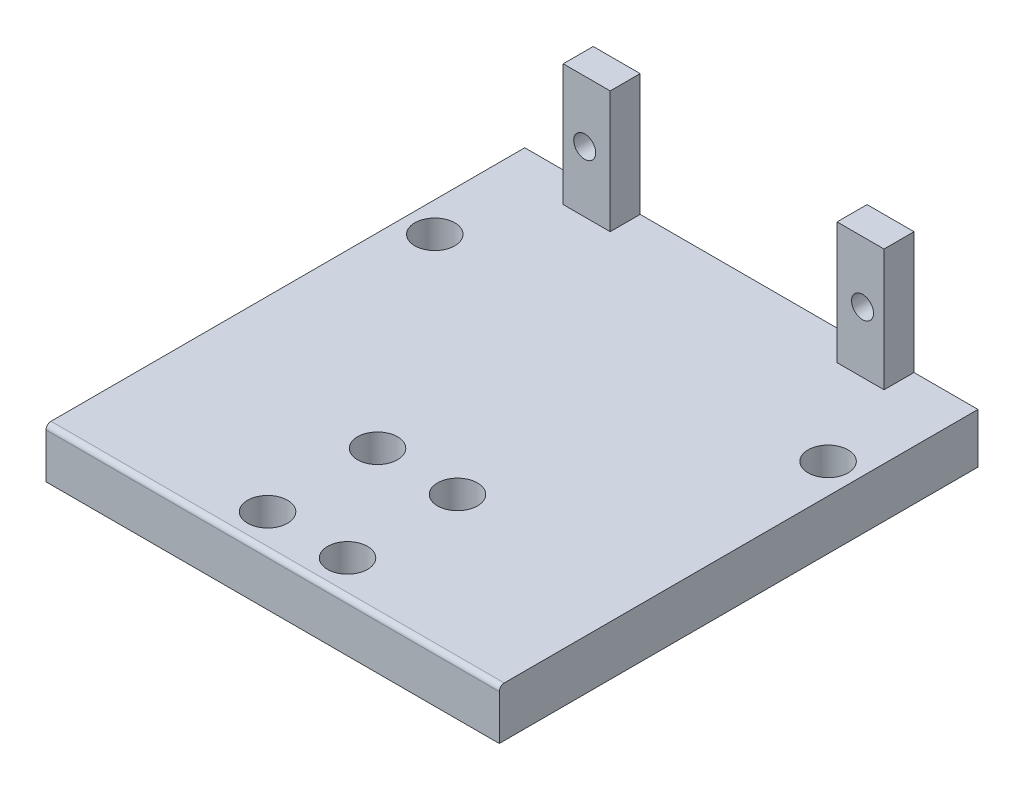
SolidWorks part; units mm, degrees
ref_plane "Front Plane" through (0, 0, 0) normal (0, 0, 1) x (1, 0, 0)
ref_plane "Top Plane" through (0, 0, 0) normal (0, 1, 0) x (1, 0, 0)
ref_plane "Right Plane" through (0, 0, 0) normal (1, 0, 0) x (0, 0, -1)
sketch "Sketch1" plane through (0, 0, 0) normal (0, 0, 1) x (1, 0, 0)
  line L0 (0, 0) -> (0, 56)
  line L1 (0, 56) -> (75.6, 56)
  line L2 (75.6, 56) -> (75.6, 0)
  line L3 (75.6, 0) -> (70.6, 0)
  line L4 (70.6, 0) -> (70.6, 51)
  line L5 (70.6, 51) -> (5, 51)
  line L6 (5, 51) -> (5, 0)
  line L7 (5, 0) -> (0, 0)
  dimension "D1" = 5
  dimension "D2" = 75.6
  dimension "D3" = 5
  dimension "D4" = 5
  dimension "D5" = 56
extrude "Boss-Extrude1" add sketch "Sketch1" along normal blind 47.9
sketch "Sketch4" plane through (0, 0, 0) normal (0, -1, 0) x (1, 0, 0)
  line L1 (-6.946, 52.7093) -> (84.5495, 52.7093)
  line L2 (-6.946, 52.7093) -> (-6.946, -4.3084)
  line L3 (-6.946, -4.3084) -> (84.5495, -4.3084)
  line L4 (84.5495, 52.7093) -> (84.5495, -4.3084)
extrude "Cut-Extrude3" cut sketch "Sketch4" against normal blind 20
sketch "Sketch6" plane through (0, 56, 0) normal (0, 1, 0) x (1, 0, 0)
  line L0 (26.9, 0) -> (26.9, -4.3)
  line L1 (75.6, 0) -> (0, 0) construction
  line L2 (26.9, -4.3) -> (22.1, -4.3)
  line L3 (22.1, -4.3) -> (22.1, -6.8)
  line L4 (22.1, -6.8) -> (26.9, -6.8)
  line L5 (26.9, -6.8) -> (26.9, -22.5)
  line L6 (26.9, -22.5) -> (49.4, -22.5)
  line L7 (49.4, -22.5) -> (49.4, -6.8)
  line L8 (49.4, -6.8) -> (54.2, -6.8)
  line L9 (54.2, -6.8) -> (54.2, -4.3)
  line L10 (54.2, -4.3) -> (49.4, -4.3)
  line L11 (49.4, -4.3) -> (49.4, 0)
  line L12 (49.4, 0) -> (26.9, 0)
  line L15 (0, -47.9) -> (0, 0) construction
  line L16 (51.4, 0) -> (51.4, -2.3)
  line L17 (51.4, -2.3) -> (56.2, -2.3)
  line L18 (56.2, -2.3) -> (56.2, -8.8)
  line L19 (56.2, -8.8) -> (51.4, -8.8)
  line L20 (51.4, -8.8) -> (51.4, -24.5)
  line L21 (51.4, -24.5) -> (24.9, -24.5)
  line L22 (24.9, -24.5) -> (24.9, -8.8)
  line L23 (24.9, -8.8) -> (20.1, -8.8)
  line L24 (20.1, -8.8) -> (20.1, -2.3)
  line L25 (20.1, -2.3) -> (24.9, -2.3)
  line L26 (24.9, -2.3) -> (24.9, 0)
  dimension "D1" = 26.9
  dimension "D2" = 4.8
  dimension "D3" = 4.8
  dimension "D4" = 4.8
  dimension "D5" = 4.8
  dimension "D6" = 22.5
  dimension "D7" = 4.3
  dimension "D8" = 4.3
  dimension "D9" = 22.5
  dimension "D10" = 2.5
  dimension "D11" = 2.5
  dimension "D12" = 2
  dimension "D13" = 2
  dimension "D14" = 2
  dimension "D15" = 2
  dimension "D16" = 2
  dimension "D17" = 2
  dimension "D18" = 2
  dimension "D19" = 2
  dimension "D20" = 2
  dimension "D21" = 2
  dimension "D22" = 2
extrude "Boss-Extrude2" add sketch "Sketch6" along normal blind 3 contours L26 L25 L24 L23 L22 L21 L20 L19 L18 L17 L16 L11 L10 L9 L8 L7 L6 L5 L4 L3 L2 L0 M7
fillet "Fillet1" radius 0.5 18 edges at (51.4, 57.5, 0) (24.9, 57.5, 0) (20.1, 56, 5.55) (22.5, 56, 8.8) (24.9, 56, 16.65) (38.15, 56, 24.5) (51.4, 56, 16.65) (53.8, 56, 8.8) (56.2, 56, 5.55) (53.8, 56, 2.3) (51.4, 56, 1.15) (63.5, 56, 0) (75.6, 56, 23.95) (37.8, 56, 47.9) (0, 56, 23.95) (12.45, 56, 0) (24.9, 56, 1.15) (22.5, 56, 2.3)
sketch "Sketch7" plane through (0, 20, 0) normal (0, -1, 0) x (1, 0, 0)
  line L1 (0, 47.9) -> (5, 47.9)
  line L2 (0, 47.9) -> (0, 0)
  line L3 (0, 0) -> (5, 0)
  line L4 (5, 47.9) -> (5, 0)
  line L5 (70.6, 47.9) -> (75.6, 47.9)
  line L6 (70.6, 47.9) -> (70.6, 0)
  line L7 (70.6, 0) -> (75.6, 0)
  line L8 (75.6, 47.9) -> (75.6, 0)
extrude "Cut-Extrude4" cut sketch "Sketch7" against normal up to surface (31 mm away)
sketch "Sketch8" plane through (0, 56, 0) normal (0, 1, 0) x (1, 0, 0)
  line L0 (0, 0) -> (24.4, 0) construction
  line L1 (15.25, 0) -> (0.25, 0)
  line L2 (15.25, 0) -> (15.25, -47.65)
  line L3 (15.25, -47.65) -> (0.25, -47.65)
  line L4 (0.25, 0) -> (0.25, -47.65)
  line L5 (0.5, -47.4) -> (0, -47.9) construction
  line L6 (75.6, -47.9) -> (0, -47.9) construction
  line L7 (75.6, 0) -> (60.6, 0)
  line L8 (75.6, 0) -> (75.6, -47.9)
  line L9 (75.6, -47.9) -> (60.6, -47.9)
  line L10 (60.6, 0) -> (60.6, -47.9)
  line L12 (0, 0) -> (15.25, 0)
  line L13 (0, 0) -> (0, -47.9)
  line L14 (0, -47.9) -> (15.25, -47.9)
  line L15 (15.25, 0) -> (15.25, -47.9)
  dimension "D1" = 15
  dimension "D2" = 15
extrude "Cut-Extrude6" cut sketch "Sketch8" against normal through all contours L2 M7 M8 M9 | L15 L3 L4 L12 L13 L14 | L1 L4 L3 L2 M9 M8 M7 | L10 M15 M13 M14 | L7 L10 L9 L8 M15 M14 M13
sketch "Sketch9" plane through (0, 59, 0) normal (0, 1, 0) x (1, 0, 0)
  line L0 (60.6, -0.5) -> (60.6, -47.4) construction
  line L1 (15.25, 0) -> (60.6, 0)
  line L2 (15.25, 0) -> (15.25, -26.396)
  line L3 (15.25, -26.396) -> (60.6, -26.396)
  line L4 (60.6, 0) -> (60.6, -26.396)
extrude "Cut-Extrude7" cut sketch "Sketch9" against normal up to surface (3 mm away)
sketch "Sketch11" plane through (0, 0, 0) normal (0, 0, -1) x (-1, 0, 0)
  line L0 (-51.034, 56) -> (-25.266, 56) construction
  line L1 (-38.15, 56) -> (-22.1, 56)
  line L2 (-38.15, 56) -> (-38.15, 68.2)
  line L3 (-38.15, 68.2) -> (-22.1, 68.2)
  line L4 (-22.1, 56) -> (-22.1, 68.2)
  line L5 (-22.1, 62.1) -> (-54.2, 62.1)
  line L6 (-38.15, 56) -> (-54.2, 56)
  line L7 (-38.15, 56) -> (-38.15, 68.2)
  line L8 (-38.15, 68.2) -> (-54.2, 68.2)
  line L9 (-54.2, 56) -> (-54.2, 68.2)
  circle A0 centre (-52.05, 62.1) radius 1.1
  circle A1 centre (-24.25, 62.1) radius 1.1
  dimension "D4" = 2.2
  dimension "D5" = 2.2
  dimension "D1" = 16.05
  dimension "D2" = 16.05
  dimension "D3" = 12.2
  dimension "D6" = 2.15
  dimension "D7" = 2.15
extrude "Boss-Extrude3" add sketch "Sketch11" against normal blind 3 contours A0 L5 L2 L8 L9 | A0 L5 L9 L6 L2 M1 | A1 L5 L4 L3 L2 | A1 L5 L2 L1 L4 M1
sketch "Sketch12" plane through (0, 0, 0) normal (0, 0, -1) x (-1, 0, 0)
  line L0 (-22.1, 68.2) -> (-54.2, 68.2) construction
  line L1 (-49.5, 68.2) -> (-26.8, 68.2)
  line L2 (-49.5, 68.2) -> (-49.5, 56)
  line L3 (-49.5, 56) -> (-26.8, 56)
  line L4 (-26.8, 68.2) -> (-26.8, 56)
  line L5 (-54.2, 56) -> (-54.2, 68.2) construction
  line L6 (-22.1, 56) -> (-22.1, 68.2) construction
  dimension "D1" = 4.7
  dimension "D2" = 4.7
extrude "Cut-Extrude8" cut sketch "Sketch12" against normal through all
sketch "Sketch13" plane through (0, 0, 0) normal (0, 0, -1) x (-1, 0, 0)
  line L1 (-60.6, 51) -> (-15.25, 51)
  line L2 (-60.6, 51) -> (-60.6, 56)
  line L3 (-60.6, 56) -> (-15.25, 56)
  line L4 (-15.25, 51) -> (-15.25, 56)
extrude "Boss-Extrude4" add sketch "Sketch13" against normal blind 3
sketch "Sketch16" plane through (0, 56, 0) normal (0, 1, 0) x (1, 0, 0)
  line L1 (15.25, 0) -> (15.25, -47.4) construction
  circle A0 centre (33.925, -33.4047) radius 2
  circle A1 centre (41.925, -33.4047) radius 2
  circle A2 centre (41.925, -44.4047) radius 2
  circle A3 centre (33.925, -44.4047) radius 2
extrude "Cut-Extrude9" cut sketch "Sketch16" against normal blind 10
sketch "Sketch18" plane through (0, 56, 0) normal (0, 1, 0) x (1, 0, 0)
  line L0 (15.25, 0) -> (22.1, 0) construction
  line L1 (15.25, 0) -> (15.25, -47.4) construction
  line L2 (60.6, 0) -> (60.6, -47.4) construction
  line L3 (54.2, 0) -> (60.6, 0) construction
  circle A0 centre (18.25, -12) radius 2
  circle A1 centre (57.6, -12) radius 2
  dimension "D1" = 4
  dimension "D2" = 4
  dimension "D3" = 12
  dimension "D4" = 3
  dimension "D5" = 3
  dimension "D6" = 12
extrude "Cut-Extrude10" cut sketch "Sketch18" against normal blind 10
equation "\"D4@Sketch16\"=37.35/2"
